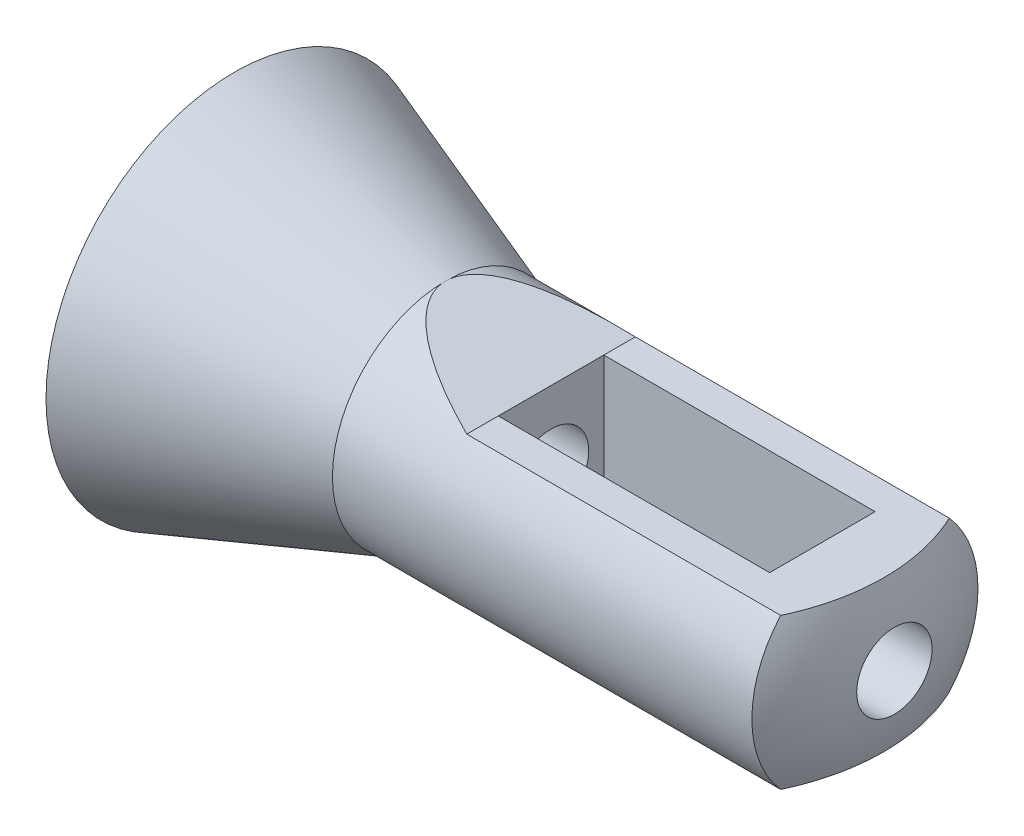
SolidWorks part; units mm, degrees
ref_plane "Front" through (0, 0, 0) normal (0, 0, 1) x (1, 0, 0)
ref_plane "Top" through (0, 0, 0) normal (0, 1, 0) x (1, 0, 0)
ref_plane "Right" through (0, 0, 0) normal (1, 0, 0) x (0, 0, -1)
sketch "Sketch1" plane through (0, 0, 0) normal (0, 1, 0) x (1, 0, 0)
  line L0 (0, 0) -> (216.4678, 0) construction
  line L1 (0, 0) -> (0, 39.6875)
  line L2 (0, 39.6875) -> (44.45, 23.8125)
  line L3 (44.45, 23.8125) -> (132.7835, 23.8125)
  line L4 (0, 0) -> (139.7, 0)
  arc A0 (132.7835, 23.8125) -> (139.7, 0) centre (95.25, 0) cw
  dimension "D1" = 44.45
  dimension "D5" = 139.7
  dimension "D2" = 79.375
  dimension "D3" = 44.45
  dimension "D4" = 47.625
revolve "Base-Revolve" add sketch "Sketch1" angle 360 about L0
sketch "Sketch2" plane through (0, 0, 0) normal (0, 0, 1) x (1, 0, 0)
  line L0 (44.45, 23.8125) -> (0, 39.6875) construction
  line L1 (66.675, 15.875) -> (0, 39.6875)
  line L2 (66.675, 15.875) -> (136.7685, 15.875)
  line L3 (0, 0) -> (139.7, 0) construction
  line L4 (0, 0) -> (216.4678, 0) construction
  arc A0 (132.7835, -23.8125) -> (132.7835, 23.8125) centre (95.25, 0) ccw construction
  dimension "D1" = 31.75
extrude "Cut-Extrude1" cut sketch "Sketch2" against normal through all and the other way through all
mirror "Mirror1" about plane through (0, 0, 0) normal (0, 1, 0) of "Cut-Extrude1"
sketch "Sketch3" plane through (0, 0, 0) normal (0, 1, 0) x (-1, 0, 0)
  line L0 (0, 0) -> (-66.675, 0) construction
  line L1 (-66.675, -11.1125) -> (-123.825, -11.1125)
  line L2 (-66.675, -11.1125) -> (-66.675, 11.1125)
  line L3 (-66.675, 11.1125) -> (-123.825, 11.1125)
  line L4 (-123.825, -11.1125) -> (-123.825, 11.1125)
  line L5 (-66.675, 17.7488) -> (-66.675, -17.7488) construction
  dimension "D1" = 57.15
  dimension "D2" = 22.225
extrude "Cut-Extrude2" cut sketch "Sketch3" against normal through all and the other way through all
sketch "Sketch4" plane through (0, 0, 0) normal (0, 1, 0) x (1, 0, 0)
  line L4 (39.1107, 8.8623) -> (-5.3393, 24.7373)
  line L7 (41.7002, 7.9375) -> (0, 22.8304)
  line L8 (41.7002, 7.9375) -> (138.9856, 7.9375)
  line L9 (0, 39.6875) -> (0, -39.6875) construction
  line L10 (132.7835, 23.8125) -> (44.45, 23.8125) construction
  line L11 (0, 0) -> (146.408, 0) construction
  line L12 (0, 0) -> (216.4678, 0) construction
  line L13 (0, 22.8304) -> (0, 0)
  line L14 (0, 0) -> (139.7, 0)
  arc A1 (132.7835, -23.8125) -> (132.7835, 23.8125) centre (95.25, 0) ccw construction
  arc A2 (139.7, 0) -> (138.9856, 7.9375) centre (95.25, 0) ccw
  dimension "D2" = 15.875
  dimension "D1" = 15.875
revolve "Cut-Revolve1" cut sketch "Sketch4" angle 360 about L11
